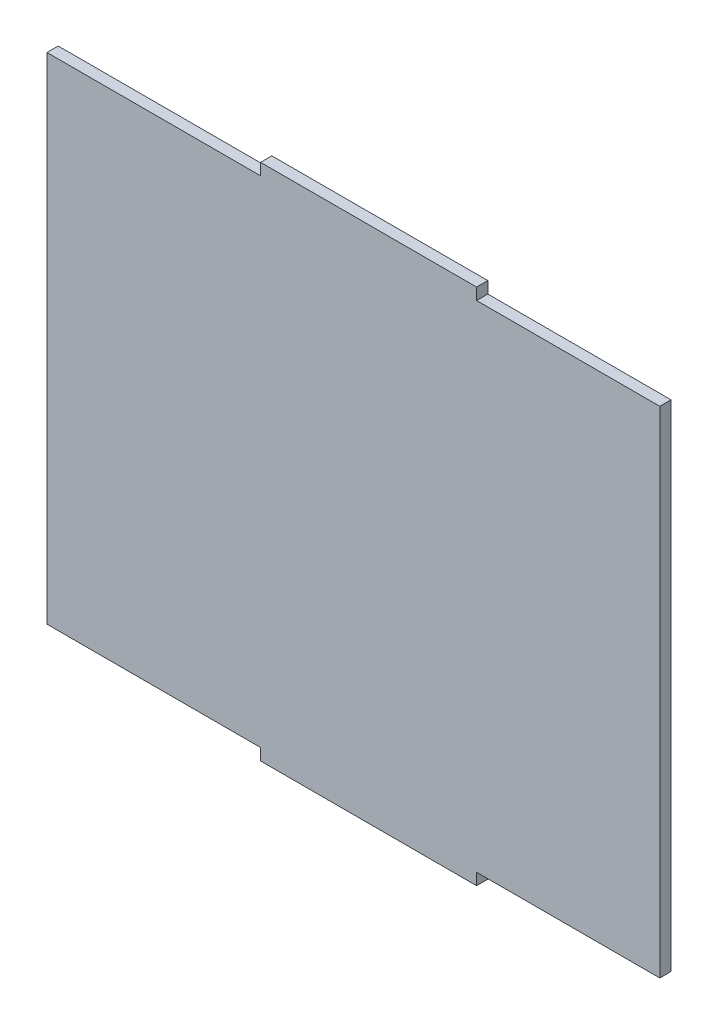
SolidWorks part; units mm, degrees
ref_plane "Alzado" through (0, 0, 0) normal (0, 0, 1) x (1, 0, 0)
ref_plane "Planta" through (0, 0, 0) normal (0, 1, 0) x (1, 0, 0)
ref_plane "Vista lateral" through (0, 0, 0) normal (1, 0, 0) x (0, 0, -1)
sketch "Croquis1" plane through (0, 0, 0) normal (0, 0, 1) x (1, 0, 0)
  line L5 (115.2441, 75.1244) -> (-39.1229, 75.1244) construction
  line L6 (60.8771, 75.1244) -> (78.8397, 75.1244)
  line L11 (78.8397, -39.4756) -> (60.8771, -39.4756)
  line L14 (-38.5603, -39.4756) -> (-38.5603, 39.4756)
  line L16 (-38.5603, 39.4756) -> (-38.5603, 75.1244)
  line L17 (-38.5603, 75.1244) -> (10.8771, 75.1244)
  line L19 (78.8397, 75.1244) -> (93.3694, 75.1244)
  line L21 (78.8397, -39.4756) -> (93.3986, -39.4756)
  line L23 (93.3694, 75.1244) -> (103.2782, 75.1244)
  line L25 (93.3986, -39.4756) -> (103.2782, -39.4756)
  line L26 (103.2782, 75.1244) -> (103.2782, -39.4756)
  line L27 (60.8771, 77.8244) -> (10.8771, 77.8244)
  line L28 (60.8771, 77.8244) -> (60.8771, 75.1244)
  line L30 (10.8771, 77.8244) -> (10.8771, 75.1244)
  line L31 (10.8771, -39.4756) -> (-38.5603, -39.4756)
  line L33 (10.8771, -39.4756) -> (10.8771, -42.1756)
  line L34 (10.8771, -42.1756) -> (60.8771, -42.1756)
  line L35 (60.8771, -39.4756) -> (60.8771, -42.1756)
  point P0 (78.8397, 39.4756)
  point P1 (81.4397, -39.4756)
  point P3 (81.4397, 39.4756)
  point P10 (-35.9603, -39.4756)
  point P11 (-35.9603, 39.4756)
  point P12 (-38.5603, -1.4756)
  point P13 (81.4397, -1.4756)
extrude "Saliente-Extruir1" add sketch "Croquis1" along normal blind 2.6
